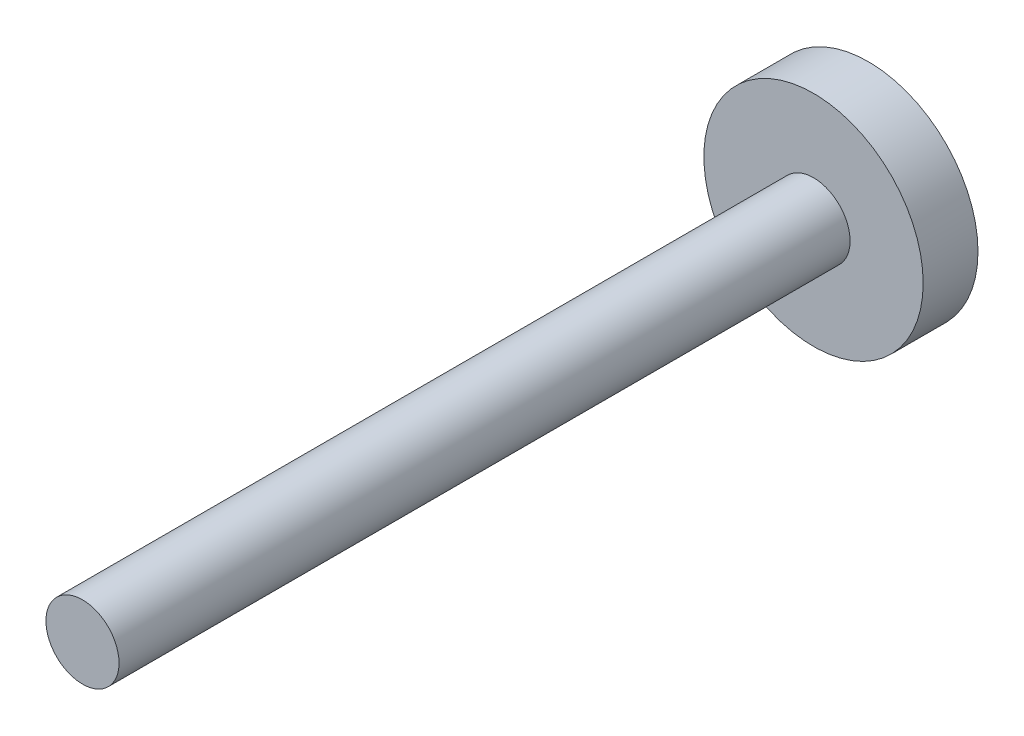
SolidWorks part; units mm, degrees
ref_plane "Alzado" through (0, 0, 0) normal (0, 0, 1) x (1, 0, 0)
ref_plane "Planta" through (0, 0, 0) normal (0, 1, 0) x (1, 0, 0)
ref_plane "Vista lateral" through (0, 0, 0) normal (1, 0, 0) x (0, 0, -1)
sketch "Croquis1" plane through (0, 0, 0) normal (0, 0, 1) x (1, 0, 0)
  circle A0 centre (0, 0) radius 6
  dimension "D1" = 12
extrude "Saliente-Extruir1" add sketch "Croquis1" along normal blind 3
sketch "Croquis2" plane through (0, 0, 3) normal (0, 0, 1) x (1, 0, 0)
  circle A0 centre (0, 0) radius 2
  dimension "D1" = 4
extrude "Saliente-Extruir2" add sketch "Croquis2" along normal blind 40
sketch "Croquis3" plane through (0, 0, 0) normal (0, 0, -1) x (-1, 0, 0)
  line L1 (2.2679, -2) -> (2.866, 0.9641)
  line L2 (2.866, 0.9641) -> (0.5981, 2.9641)
  line L3 (0.5981, 2.9641) -> (-2.2679, 2)
  line L4 (-2.2679, 2) -> (-2.866, -0.9641)
  line L5 (-2.866, -0.9641) -> (-0.5981, -2.9641)
  line L6 (-0.5981, -2.9641) -> (2.2679, -2)
  circle A0 centre (0, 0) radius 2.6187 construction
  dimension "D1" = 2
extrude "Cortar-Extruir1" cut sketch "Croquis3" against normal blind 2
